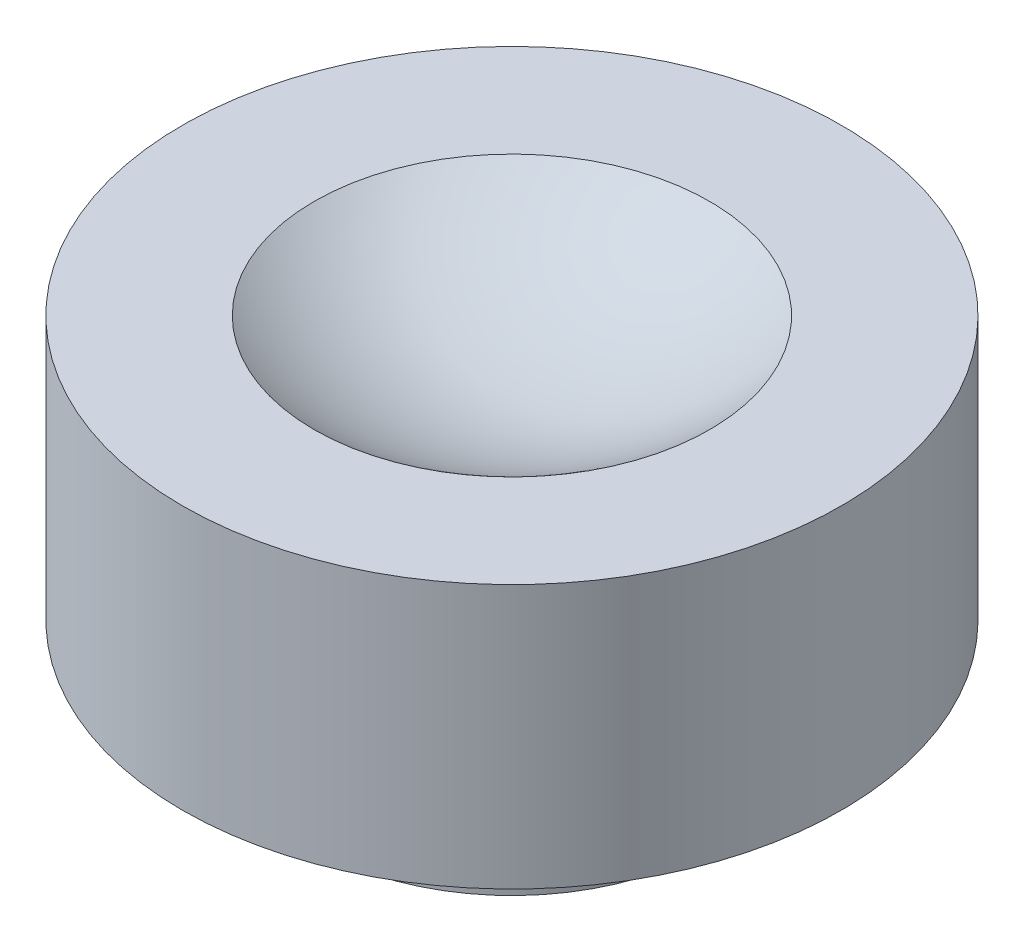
SolidWorks part; units mm, degrees
ref_plane "Plan1" through (0, 0, 0) normal (0, 0, 1) x (1, 0, 0)
ref_plane "Plan2" through (0, 0, 0) normal (0, 1, 0) x (1, 0, 0)
ref_plane "Plan3" through (0, 0, 0) normal (1, 0, 0) x (0, 0, -1)
sketch "Esquisse1" plane through (0, 0, 0) normal (0, 0, 1) x (1, 0, 0)
  line L0 (0, 60) -> (0, -80) construction
  line L1 (0, 34.5) -> (0, 39)
  line L2 (-5, 40) -> (-5, 36)
  line L3 (-3, 36) -> (-3, 34.5)
  line L4 (-5, 36) -> (-3, 36)
  line L5 (-3, 34.5) -> (0, 34.5)
  line L6 (-3, 40) -> (-5, 40)
  arc A0 (0, 39) -> (-3, 40) centre (0, 44) cw
  point P14 (0, 36.5)
  point P17 (0, 40)
  dimension "D6" = 5
  dimension "D1" = 5
  dimension "D2" = 4
  dimension "D3" = 3
  dimension "D4" = 1.5
revolve "Base-Révolution" add sketch "Esquisse1" angle 360 about L0
